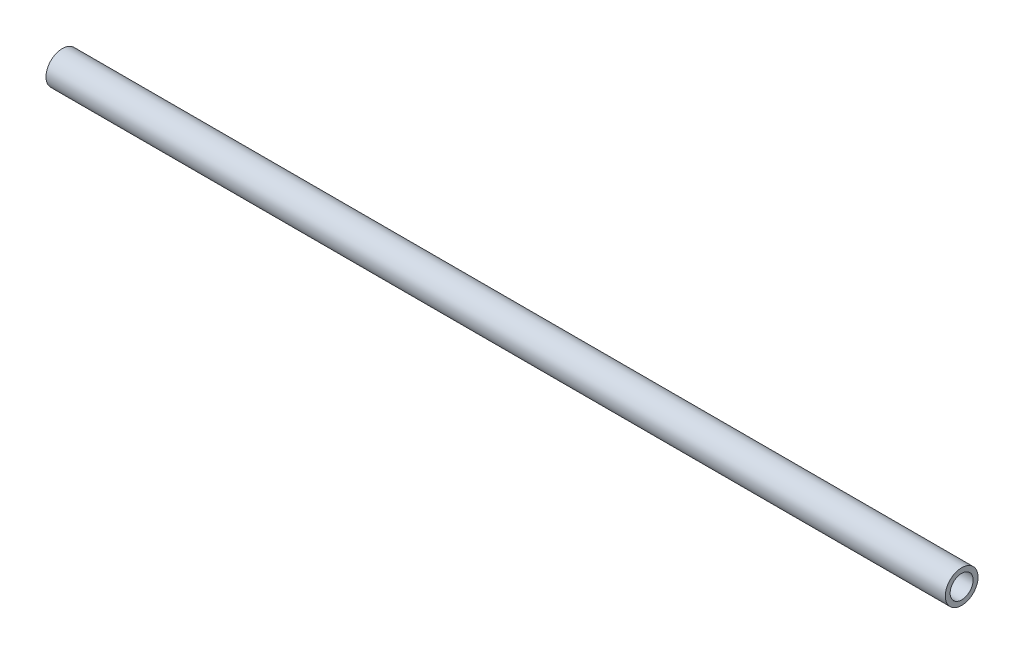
SolidWorks part; units mm, degrees
ref_plane "Front Plane" through (0, 0, 0) normal (0, 0, 1) x (1, 0, 0)
ref_plane "Top Plane" through (0, 0, 0) normal (0, 1, 0) x (1, 0, 0)
ref_plane "Right Plane" through (0, 0, 0) normal (1, 0, 0) x (0, 0, -1)
sketch "Sketch3" plane through (0, 0, 0) normal (1, 0, 0) x (0, 0, -1)
  circle A0 centre (0, 0) radius 3.8989
  circle A1 centre (0, 0) radius 5.5499
  dimension "D1" = 11.0998
  dimension "D2" = 7.7978
extrude "Boss-Extrude1" add sketch "Sketch3" along normal blind 304.8 separate body
